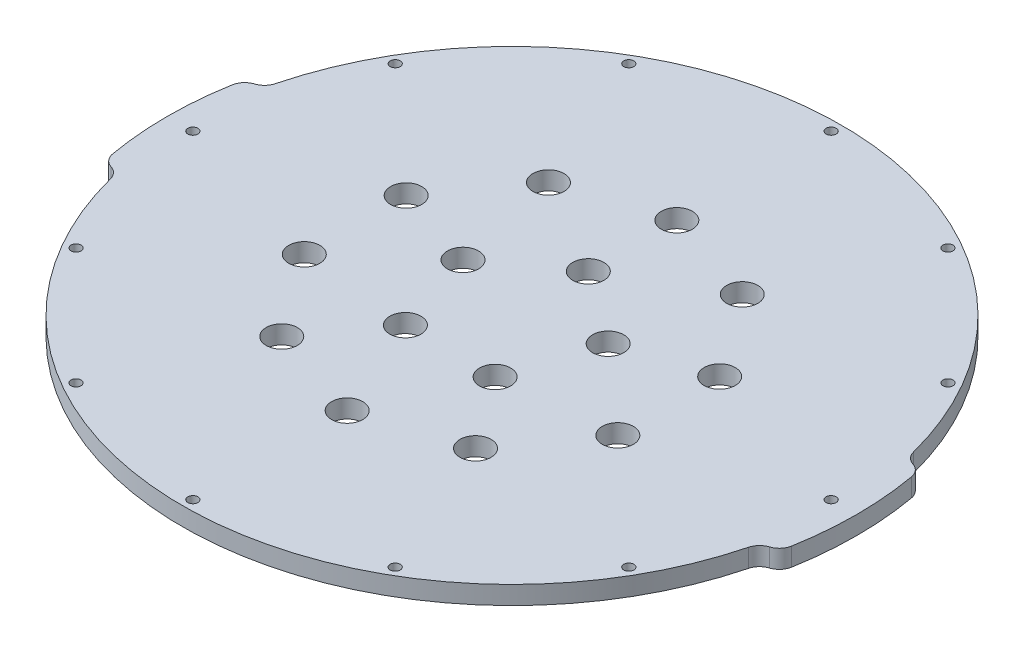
SolidWorks part; units mm, degrees
ref_plane "Front Plane" through (0, 0, 0) normal (0, 0, 1) x (1, 0, 0)
ref_plane "Top Plane" through (0, 0, 0) normal (0, 1, 0) x (1, 0, 0)
ref_plane "Right Plane" through (0, 0, 0) normal (1, 0, 0) x (0, 0, -1)
sketch "Sketch1" plane through (0, 0, 0) normal (0, 1, 0) x (1, 0, 0)
  line L0 (0, 0) -> (-111.234, 19.6136) construction
  line L1 (0, 0) -> (-139.7786, 0) construction
  line L2 (0, 0) -> (-111.234, -19.6136) construction
  line L3 (0, 0) -> (111.234, 19.6136) construction
  line L4 (0, 0) -> (111.234, -19.6136) construction
  circle A0 centre (0, 0) radius 104.55 construction
  circle A1 centre (0, 104.55) radius 1.65
  circle A2 centre (52.275, 90.543) radius 1.65
  circle A3 centre (90.543, 52.275) radius 1.65
  circle A4 centre (104.55, 0) radius 1.65
  circle A5 centre (90.543, -52.275) radius 1.65
  circle A6 centre (52.275, -90.543) radius 1.65
  circle A7 centre (0, -104.55) radius 1.65
  circle A8 centre (-52.275, -90.543) radius 1.65
  circle A9 centre (-90.543, -52.275) radius 1.65
  circle A10 centre (-104.55, 0) radius 1.65
  circle A11 centre (-90.543, 52.275) radius 1.65
  circle A12 centre (-52.275, 90.543) radius 1.65
  circle A13 centre (0, 0) radius 107.95 construction
  circle A14 centre (0, 0) radius 112.95 construction
  arc A15 (-111.234, -19.6136) -> (-111.234, 19.6136) centre (0, 0) cw
  arc A16 (111.234, -19.6136) -> (111.234, 19.6136) centre (0, 0) ccw
  arc A17 (-111.234, -19.6136) -> (-105.328, -23.6479) centre (-106.31, -18.7453) ccw
  arc A18 (-111.234, 19.6136) -> (-105.328, 23.6479) centre (-106.31, 18.7453) cw
  arc A19 (111.234, -19.6136) -> (105.328, -23.6479) centre (106.31, -18.7453) cw
  arc A20 (111.234, 19.6136) -> (105.328, 23.6479) centre (106.31, 18.7453) ccw
  arc A21 (-105.328, 23.6479) -> (105.328, 23.6479) centre (0, 0) cw
  arc A22 (105.328, -23.6479) -> (-105.328, -23.6479) centre (0, 0) cw
  point P30 (0, 0)
  dimension "D1" = 3.3
  dimension "D2" = 209.1
  dimension "D4" = 215.9
  dimension "D5" = 5
  dimension "D6" = 10
  dimension "D3" = 12
extrude "Boss-Extrude1" add sketch "Sketch1" along normal blind 6
fillet "Fillet1" radius 5 4 edges at (105.328, 3, 23.6479) (105.328, 3, -23.6479) (-105.328, 3, -23.6479) (-105.328, 3, 23.6479)
sketch "Sketch2" plane through (0, 6, 0) normal (0, 1, 0) x (1, 0, 0)
  line L0 (0, 0) -> (0, -107.95) construction
  line L1 (0, 0) -> (14.6946, -20.2254) construction
  circle A0 centre (0, 54) radius 5.1
  circle A1 centre (0, 0) radius 54 construction
  circle A2 centre (31.7404, 43.6869) radius 5.1
  circle A3 centre (51.3571, 16.6869) radius 5.1
  circle A4 centre (51.3571, -16.6869) radius 5.1
  circle A5 centre (31.7404, -43.6869) radius 5.1
  arc A6 (-104.514, -27.019) -> (104.514, -27.019) centre (0, 0) ccw construction
  circle A7 centre (0, -54) radius 5.1
  circle A8 centre (-31.7404, -43.6869) radius 5.1
  circle A9 centre (-51.3571, -16.6869) radius 5.1
  circle A10 centre (-51.3571, 16.6869) radius 5.1
  circle A11 centre (-31.7404, 43.6869) radius 5.1
  circle A12 centre (0, 0) radius 25 construction
  circle A13 centre (14.6946, -20.2254) radius 5.1
  circle A14 centre (-14.6946, -20.2254) radius 5.1
  circle A15 centre (-23.7764, 7.7254) radius 5.1
  circle A16 centre (0, 25) radius 5.1
  circle A17 centre (23.7764, 7.7254) radius 5.1
  point P5 (0, -54)
  point P16 (0, 0)
  point P43 (0, 0)
  dimension "D1" = 10.2
  dimension "D3" = 108
  dimension "D4" = 50
  dimension "D5" = 5
  dimension "D6" = 36
  dimension "D2" = 10
extrude "Cut-Extrude1" cut sketch "Sketch2" against normal through all
